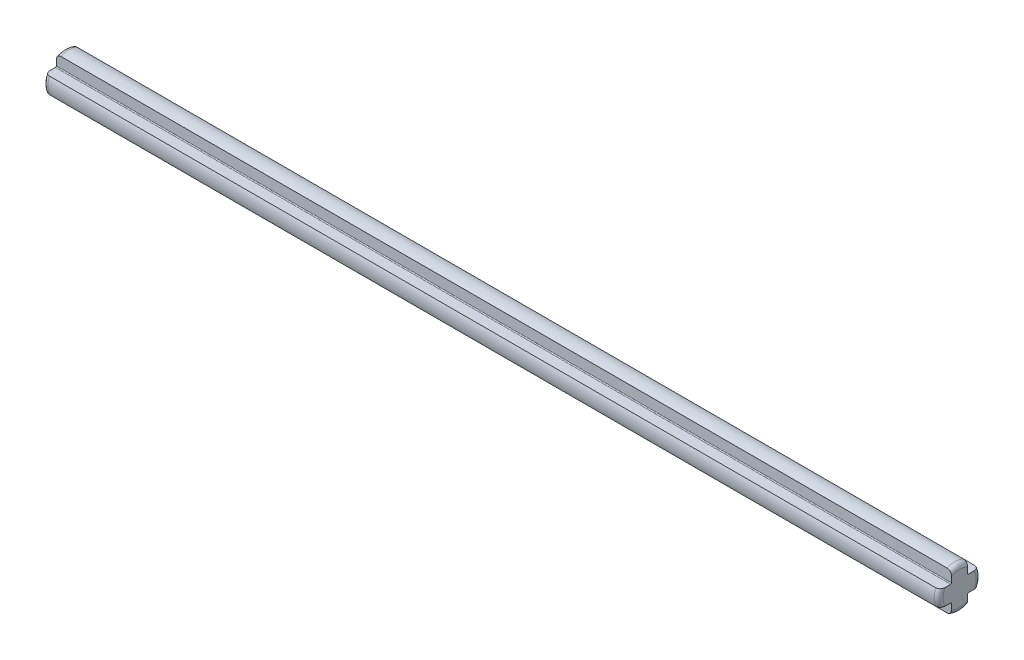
SolidWorks part; units mm, degrees
ref_plane "Alzado" through (0, 0, 0) normal (0, 0, 1) x (1, 0, 0)
ref_plane "Planta" through (0, 0, 0) normal (0, 1, 0) x (1, 0, 0)
ref_plane "Vista lateral" through (0, 0, 0) normal (1, 0, 0) x (0, 0, -1)
sketch "Croquis1" plane through (0, 0, 0) normal (1, 0, 0) x (0, 0, -1)
  line L0 (-3.7919, 0) -> (3.9132, 0) construction
  line L1 (-0.9, 2.1708) -> (-0.9, 1)
  line L2 (-2.1708, 0.9) -> (-1, 0.9)
  line L3 (2.1708, 0.9) -> (1, 0.9)
  line L4 (0.9, 2.1708) -> (0.9, 1)
  line L5 (0, 3.4809) -> (0, -0.8787) construction
  line L6 (0.9, -2.1708) -> (0.9, -1)
  line L7 (2.1708, -0.9) -> (1, -0.9)
  line L8 (-2.1708, -0.9) -> (-1, -0.9)
  line L9 (-0.9, -2.1708) -> (-0.9, -1)
  arc A0 (-2.1708, 0.9) -> (-2.1708, -0.9) centre (0, 0) ccw
  arc A1 (0.9, 2.1708) -> (-0.9, 2.1708) centre (0, 0) ccw
  arc A2 (-1, 0.9) -> (-0.9, 1) centre (-1, 1) ccw
  arc A3 (1, 0.9) -> (0.9, 1) centre (1, 1) cw
  arc A4 (2.1708, 0.9) -> (2.1708, -0.9) centre (0, 0) cw
  arc A5 (1, -0.9) -> (0.9, -1) centre (1, -1) ccw
  arc A6 (-1, -0.9) -> (-0.9, -1) centre (-1, -1) cw
  arc A7 (0.9, -2.1708) -> (-0.9, -2.1708) centre (0, 0) cw
  dimension "D1" = 2.35
  dimension "D4" = 0.1
  dimension "D2" = 1.8
  dimension "D3" = 1.8
extrude "Extruir1" add sketch "Croquis1" along normal mid plane 100
fillet "Redondeo1" radius 0.5 8 edges at (50, 2.35, 0) (50, 0, -2.35) (50, -2.35, 0) (50, 0, 2.35) (-50, -2.35, 0) (-50, 0, -2.35) (-50, 2.35, 0) (-50, 0, 2.35)
